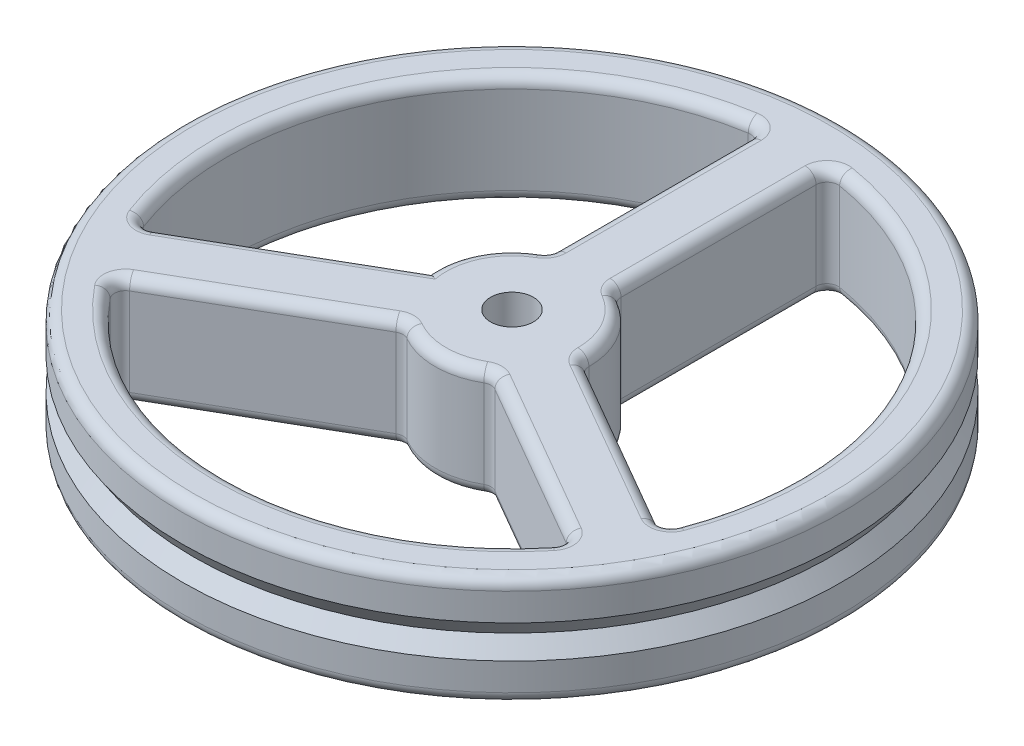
SolidWorks part; units mm, degrees
ref_plane "Front Plane" through (0, 0, 0) normal (0, 0, 1) x (1, 0, 0)
ref_plane "Top Plane" through (0, 0, 0) normal (0, 1, 0) x (1, 0, 0)
ref_plane "Right Plane" through (0, 0, 0) normal (1, 0, 0) x (0, 0, -1)
sketch "Sketch1" plane through (0, 0, 0) normal (0, 1, 0) x (1, 0, 0)
  line L0 (0, 7) -> (0, 26) construction
  line L1 (3, 25.8263) -> (3, 6.3246)
  line L2 (-3, 25.8263) -> (-3, 6.3246)
  line L3 (20.8663, -15.5112) -> (3.9772, -5.7604)
  line L4 (6.0622, -3.5) -> (22.5167, -13) construction
  line L5 (23.8663, -10.3151) -> (6.9772, -0.5642)
  line L6 (-23.8663, -10.3151) -> (-6.9772, -0.5642)
  line L7 (-6.0622, -3.5) -> (-22.5167, -13) construction
  line L8 (-20.8663, -15.5112) -> (-3.9772, -5.7604)
  circle A0 centre (0, 0) radius 30
  circle A1 centre (0, 0) radius 4 construction
  arc A2 (-3.9772, -5.7604) -> (3.9772, -5.7604) centre (0, 0) ccw
  arc A3 (-20.8663, -15.5112) -> (20.8663, -15.5112) centre (0, 0) ccw
  arc A4 (-3, 6.3246) -> (-6.9772, -0.5642) centre (0, 0) ccw
  arc A5 (6.9772, -0.5642) -> (3, 6.3246) centre (0, 0) ccw
  arc A6 (23.8663, -10.3151) -> (3, 25.8263) centre (0, 0) ccw
  arc A7 (-3, 25.8263) -> (-23.8663, -10.3151) centre (0, 0) ccw
  point P26 (0, 0)
  dimension "D1" = 60
  dimension "D2" = 8
  dimension "D3" = 14
  dimension "D4" = 52
  dimension "D5" = 3
  dimension "D6" = 3
extrude "Boss-Extrude1" add sketch "Sketch1" along normal blind 10
fillet "Fillet1" radius 1 37 edges at (-6.0622, 10, -3.5) (-6.0622, 0, -3.5) (-15.4217, 10, 5.4396) (-15.4217, 0, 5.4396) (6.0622, 10, -3.5) (6.0622, 0, -3.5) (22.5167, 10, -13) (22.5167, 0, -13) (0, 10, 26) (0, 0, 26) (0, 10, 7) (0, 0, 7) (-3, 10, -16.0754) (-3, 5, -6.3246) (-3, 0, -16.0754) (-23.8663, 5, 10.3151) (-22.5167, 10, -13) (-3, 5, -25.8263) (-22.5167, 0, -13) (3.9772, 5, 5.7604) (12.4217, 10, 10.6358) (20.8663, 5, 15.5112) (12.4217, 0, 10.6358) (23.8663, 5, 10.3151) (15.4217, 10, 5.4396) (6.9772, 5, 0.5642) (15.4217, 0, 5.4396) (3, 5, -6.3246) (3, 10, -16.0754) (3, 5, -25.8263) (3, 0, -16.0754) (-20.8663, 5, 15.5112) (-12.4217, 10, 10.6358) (-3.9772, 5, 5.7604) (-12.4217, 0, 10.6358) (0, 0, 30) (0, 10, 30)
sketch "Sketch3" plane through (0, 0, 0) normal (0, -1, 0) x (1, 0, 0)
  circle A0 centre (0, 0) radius 1.95
  dimension "D1" = 3.9
extrude "Cut-Extrude1" cut sketch "Sketch3" against normal through all
sketch "Sketch4" plane through (0, 0, 0) normal (1, 0, 0) x (0, 0, -1)
  line L0 (-30, 3.5) -> (-30, 6.5)
  line L1 (-30, 9) -> (-30, 1) construction
  line L2 (-30, 6.5) -> (-29, 6.5) construction
  line L3 (-29, 6.5) -> (-29, 3.5) construction
  line L4 (-29, 5) -> (-30, 5) construction
  line L5 (-30, 3.5) -> (-29, 3.5) construction
  line L6 (-30, 3.5) -> (-29, 5)
  line L7 (-29, 5) -> (-30, 6.5)
  dimension "D1" = 3
  dimension "D2" = 1
revolve "Cut-Revolve1" cut sketch "Sketch4" angle 360 about axis through (0, 10, 0) along (0, -1, 0)
